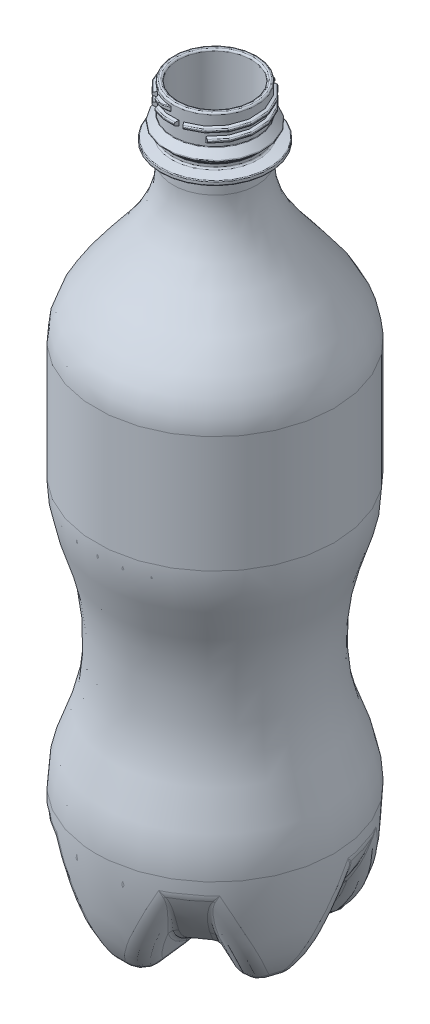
SolidWorks part; units mm, degrees
other "<Bottle Bottom>-<Imported1>"
other "<Bottle Neck>-<Imported1>"
ref_plane "Front Plane" through (0, 0, 0) normal (0, 0, 1) x (1, 0, 0)
ref_plane "Top Plane" through (0, 0, 0) normal (0, 1, 0) x (1, 0, 0)
ref_plane "Right Plane" through (0, 0, 0) normal (1, 0, 0) x (0, 0, -1)
inserted part "Bottle Bottom"
inserted part "Bottle Neck"
move or copy body "Body-Move/Copy2"
sketch "Sketch1" plane through (0, 0, 0) normal (0, 0, 1) x (1, 0, 0)
  line L0 (-36.195, 151.1062) -> (-36.195, 115.698)
  line L1 (-36.195, 43.8687) -> (-36.195, 23.8678) construction
  line L2 (-36.195, 123.2934) -> (-36.195, 90.9673) construction
  line L3 (-12.7, 202.946) -> (-12.7, 198.12) construction
  line L4 (0, 0) -> (0, 219.71) construction
  line L5 (12.192, 219.71) -> (-12.192, 219.71) construction
  spline S0 degree 3 poles (-36.195, 33.8683) (-36.195, 47.4742) (-28.0158, 53.076) (-28.7797, 95.8528) (-36.195, 101.9638) (-36.195, 115.698) knots 0 0 0 0 0.432693 0.532693 1 1 1 1
  spline S1 degree 3 poles (-36.195, 151.1062) (-36.195, 167.6191) (-12.7, 178.0415) (-12.7, 198.12) knots 0 0 0 0 1 1 1 1
revolve "Revolve-Thin1" add sketch "Sketch1" angle 360 about L4
ref_plane "Plane1" through (0, 190.5, 0) normal (0, 1, 0) x (1, 0, 0)
other "Intersect1"
